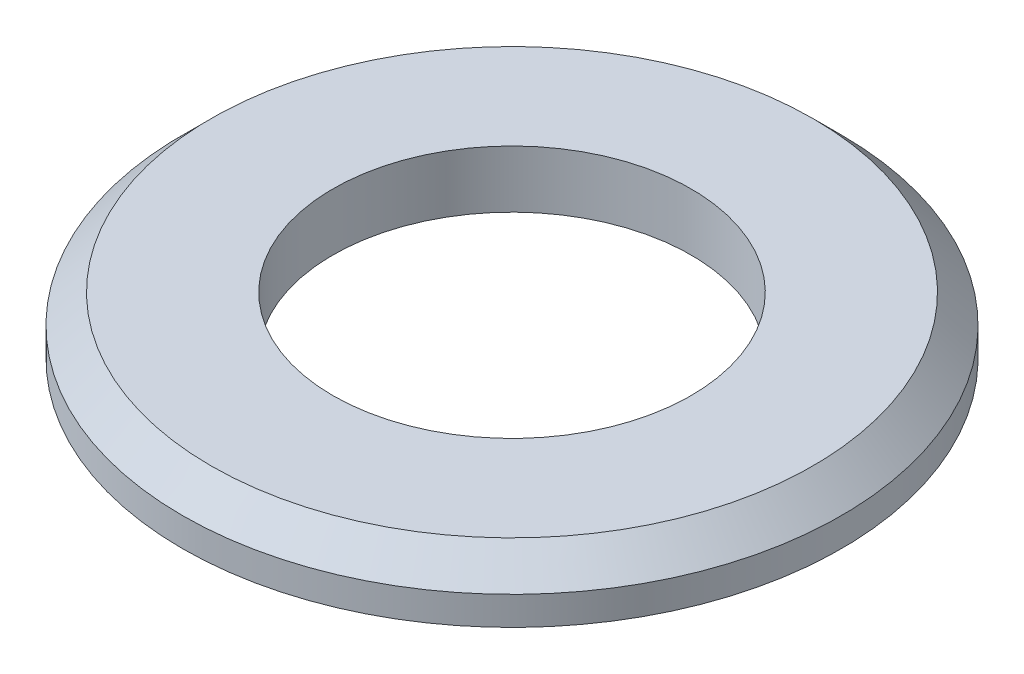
SolidWorks part; units mm, degrees
ref_plane "Front" through (0, 0, 0) normal (0, 0, 1) x (1, 0, 0)
ref_plane "Top" through (0, 0, 0) normal (0, 1, 0) x (1, 0, 0)
ref_plane "Right" through (0, 0, 0) normal (1, 0, 0) x (0, 0, -1)
sketch "Sketch1" plane through (0, 0, 0) normal (0, 1, 0) x (1, 0, 0)
  circle A0 centre (0, 0) radius 25
  circle A1 centre (0, 0) radius 46
extrude "Extrude1" add sketch "Sketch1" along normal blind 8
chamfer "Chamfer1" distance 4 1 edges at (0, 8, 46)
